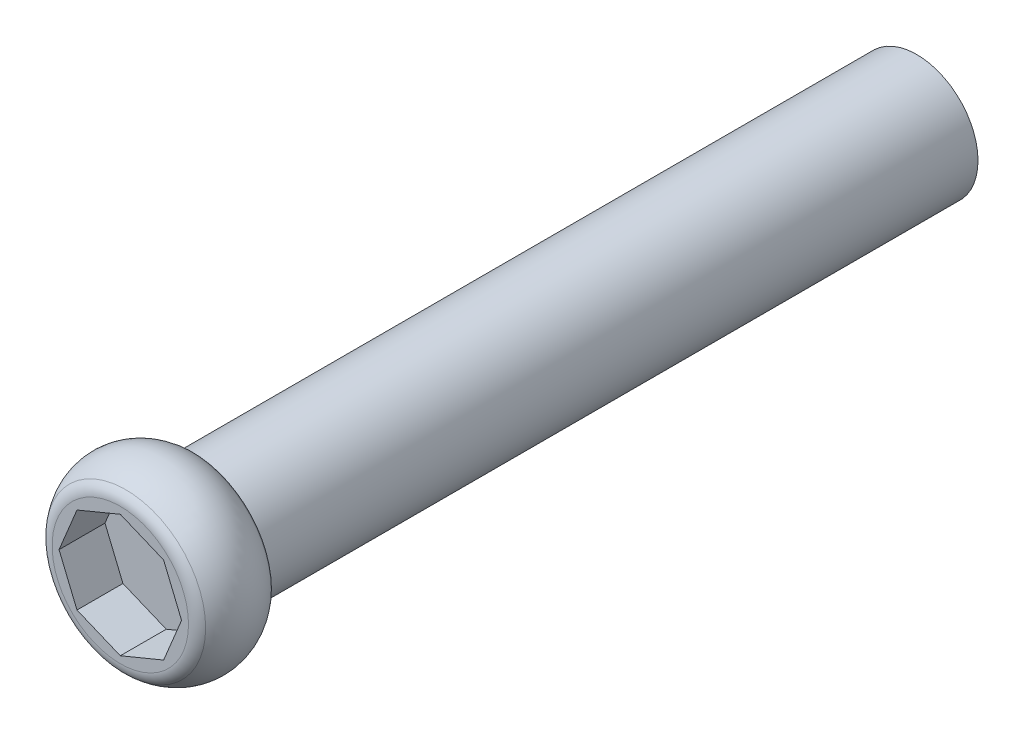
SolidWorks part; units mm, degrees
other "<Lock Pin_01>-<Cut-Extrude1>"
ref_plane "Front Plane" through (0, 0, 0) normal (0, 0, 1) x (1, 0, 0)
ref_plane "Top Plane" through (0, 0, 0) normal (0, 1, 0) x (1, 0, 0)
ref_plane "Right Plane" through (0, 0, 0) normal (1, 0, 0) x (0, 0, -1)
mirrored part "Lock Pin_01_Mirrored"
